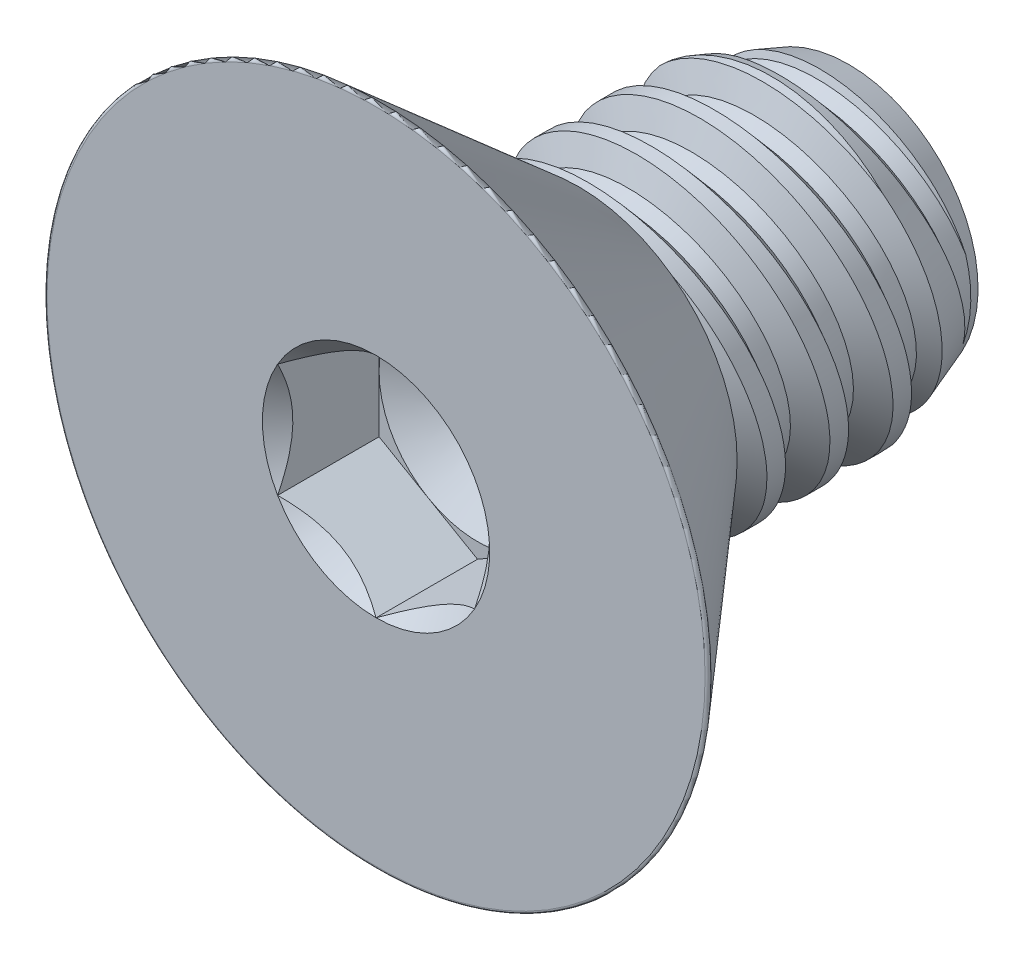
SolidWorks part; units mm, degrees
ref_plane "Front" through (0, 0, 0) normal (0, 0, 1) x (1, 0, 0)
ref_plane "Top" through (0, 0, 0) normal (0, 1, 0) x (1, 0, 0)
ref_plane "Right" through (0, 0, 0) normal (1, 0, 0) x (0, 0, -1)
sketch "Sketch1" plane through (0, 0, 0) normal (1, 0, 0) x (0, 0, -1)
  line L0 (0, 0) -> (-4.0894, 0) construction
  line L1 (0, 0) -> (5.4356, 0)
  line L2 (0, 0) -> (0, 3.175)
  line L3 (0, 3.175) -> (5.4356, 3.175)
  line L4 (5.4356, 0) -> (5.4356, 3.175)
  line L5 (0, -3.175) -> (5.4356, -3.175) construction
  dimension "D1" = 5.4356
  dimension "Thread Dia" = 6.35
  dimension "Length" = 9.525
  dimension "Head Height" = 4.0894
revolve "Revolve1" add sketch "Sketch1" angle 360 about L0
ref_plane "Plane1" through (0, 0, 4.0894) normal (0, 0, 1) x (1, 0, 0)
sketch "Sketch2" plane through (0, 0, 0) normal (1, 0, 0) x (0, 0, -1)
  line L0 (0, 3.175) -> (0, -3.175) construction
  line L1 (0, -3.175) -> (1.27, -3.175) construction
  line L2 (1.27, -3.175) -> (0, 3.175) construction
  line L3 (0, 3.175) -> (0.1557, 3.2061) construction
  line L4 (0.1557, 3.2061) -> (1.2453, 3.4241)
  line L5 (1.2453, 3.4241) -> (0.991, 2.6722)
  line L6 (0.991, 2.6722) -> (0.6796, 2.6099)
  line L7 (0.6796, 2.6099) -> (0.1557, 3.2061)
  line L8 (0.8353, 2.641) -> (0.7005, 3.3151) construction
  line L9 (0, -3.175) -> (5.4356, -3.175) construction
  line L10 (0, 3.175) -> (5.4356, 3.175) construction
  line L12 (0.7285, 3.175) -> (1.9985, -3.175) construction
  line L13 (0, -0.2727) -> (2.727, 0.2727) construction
  line L15 (0, 0) -> (0, 3.175) construction
  point P19 (1.3635, 0)
  dimension "D1" = 60
  dimension "Thread Pitch" = 1.27
  dimension "D2" = 0.1588
  dimension "D3" = 0.3175
  dimension "D4" = 1.27
revolve "Cut-Revolve1" cut sketch "Sketch2" angle 360 about L13
sketch "Sketch3" plane through (0, 0, 0) normal (1, 0, 0) x (0, 0, -1)
  line L0 (5.4356, 2.6099) -> (3.883, 3.175)
  line L1 (3.883, 3.175) -> (5.4356, 3.175)
  line L2 (5.4356, 3.175) -> (5.4356, 2.6099)
  line L3 (0, 3.175) -> (5.4356, 3.175) construction
  line L4 (5.4356, 0) -> (5.4356, 3.175) construction
  line L5 (3.883, 0) -> (0, 0) construction
  line L6 (3.883, 3.175) -> (3.883, -3.175) construction
  line L7 (0, -3.175) -> (5.4356, -3.175) construction
  dimension "D1" = 20
  dimension "D2" = 6.35
revolve "Cut-Revolve2" cut sketch "Sketch3" angle 360 about L5
pattern_linear "LPattern1" count 4 spacing 1.27 along (0, 0, 1)
pattern_linear "LPattern2" count 2 spacing 1.27 along (0, 0, 1)
sketch "Sketch4" plane through (0, 0, 0) normal (0, 0, 1) x (1, 0, 0)
  circle A0 centre (0, 0) radius 6.7437
  dimension "Head Dia" = 13.4874
extrude "Extrude1" add sketch "Sketch4" along normal up to surface (4.0894 mm away)
sketch "Sketch9" plane through (0, 0, 0) normal (1, 0, 0) x (0, 0, -1)
  line L0 (-4.0894, 6.7437) -> (0, 3.1888)
  line L1 (0, 3.1888) -> (0, 6.7437)
  line L2 (0, 6.7437) -> (-4.0894, 6.7437)
  line L3 (0, 0) -> (-4.0894, 0) construction
  line L6 (-4.0894, -6.7437) -> (0, -3.1888) construction
  line L7 (0, -6.7437) -> (0, 6.7437) construction
  line L8 (-4.0894, 6.7437) -> (-4.0894, -6.7437) construction
  line L9 (0, 6.7437) -> (-4.0894, 6.7437) construction
  dimension "D1" = 82
revolve "Cut-Revolve3" cut sketch "Sketch9" angle 360 about L3
fillet "Fillet1" radius 0.0508
sketch "Sketch6" plane through (0, 0, 4.0894) normal (0, 0, 1) x (1, 0, 0)
  line L1 (0, -2.2914) -> (1.9844, -1.1457)
  line L2 (1.9844, -1.1457) -> (1.9844, 1.1457)
  line L3 (1.9844, 1.1457) -> (0, 2.2914)
  line L4 (0, 2.2914) -> (-1.9844, 1.1457)
  line L5 (-1.9844, 1.1457) -> (-1.9844, -1.1457)
  line L6 (-1.9844, -1.1457) -> (0, -2.2914)
  circle A0 centre (0, 0) radius 1.9844 construction
  dimension "Hex" = 3.9688
extrude "Cut-Extrude1" cut sketch "Sketch6" against normal blind 2.0447
sketch "Sketch7" plane through (0, 0, 4.0894) normal (0, 0, 1) x (1, 0, 0)
  circle A0 centre (0, 0) radius 2.2914
extrude "Cut-Extrude4" cut sketch "Sketch7" against normal blind 2.0447 draft 45
sketch "Sketch8" plane through (0, 0, 2.0447) normal (0, 0, 1) x (1, 0, 0)
  circle A0 centre (0, 0) radius 1.9844 construction
  circle A1 centre (0, 0) radius 1.9844
extrude "Cut-Extrude5" cut sketch "Sketch8" against normal blind 0.6816 draft 60
equation "\"D2@Sketch2\"=\"Thread Pitch@Sketch2\"/8"
equation "\"D3@Sketch2\"=\"Thread Pitch@Sketch2\"/4"
equation "\"D4@Sketch2\"=\"Thread Pitch@Sketch2\""
equation "\"D3@LPattern1\"=\"Thread Pitch@Sketch2\""
equation "\"D1@Cut-Extrude1\"=\"Head Height@Sketch1\"/2"
equation "\"D1@Cut-Extrude4\"=\"D1@Cut-Extrude1\""
equation "\"D1@Cut-Extrude5\"=\"D1@Cut-Extrude1\"/3"
equation "\"D1@LPattern1\"=\"D1@Sketch1\"/\"Thread Pitch@Sketch2\""
equation "\"D3@LPattern2\"=\"Thread Pitch@Sketch2\""
